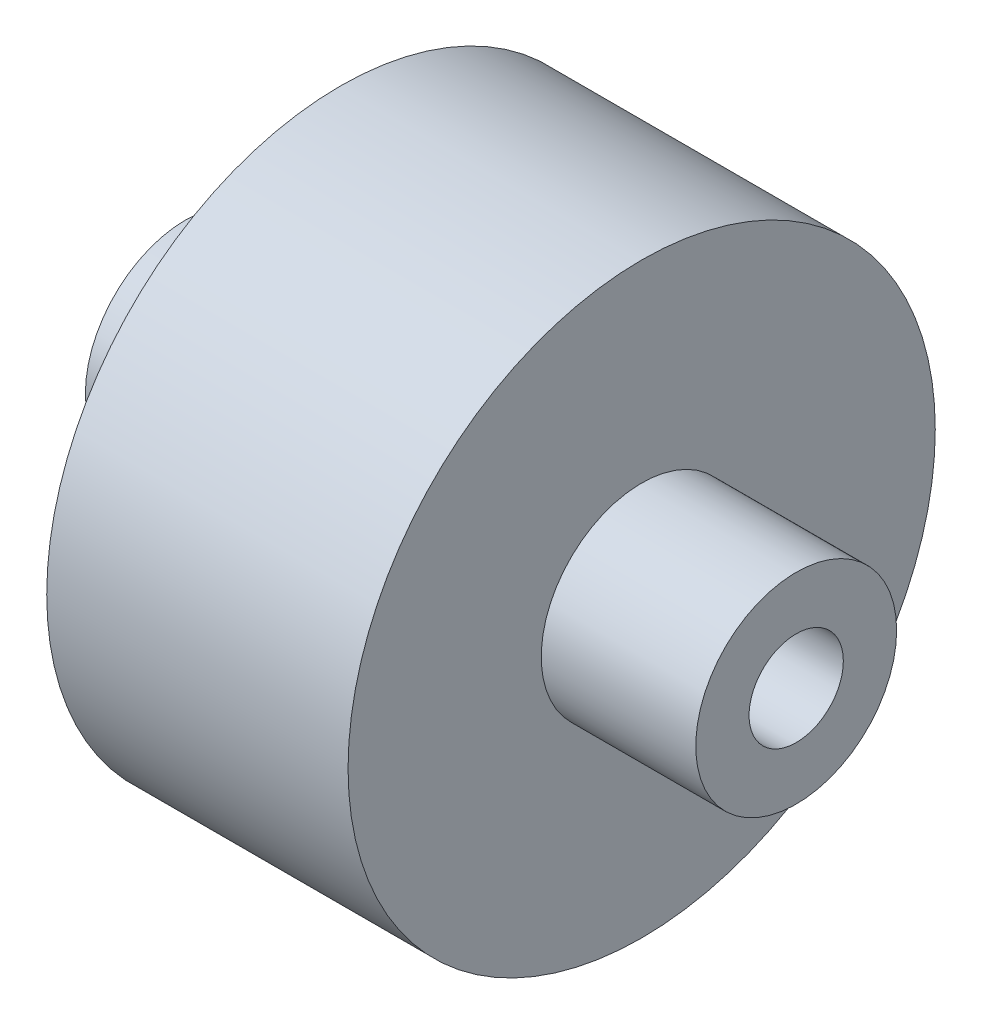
SolidWorks part; units mm, degrees
ref_plane "Front Plane" through (0, 0, 0) normal (0, 0, 1) x (1, 0, 0)
ref_plane "Top Plane" through (0, 0, 0) normal (0, 1, 0) x (1, 0, 0)
ref_plane "Right Plane" through (0, 0, 0) normal (1, 0, 0) x (0, 0, -1)
sketch "Sketch1" plane through (0, 0, 0) normal (1, 0, 0) x (0, 0, -1)
  circle A0 centre (0, 0) radius 19
  dimension "D1" = 38
extrude "Boss-Extrude1" add sketch "Sketch1" along normal blind 19.5
sketch "Sketch2" plane through (19.5, 0, 0) normal (1, 0, 0) x (0, 0, -1)
  circle A0 centre (0, 0) radius 6.5
  dimension "D1" = 13
extrude "Boss-Extrude2" add sketch "Sketch2" along normal blind 10
sketch "Sketch3" plane through (0, 0, 0) normal (-1, 0, 0) x (0, 0, 1)
  circle A0 centre (0, 0) radius 6.5
  dimension "D1" = 13
extrude "Boss-Extrude3" add sketch "Sketch3" along normal blind 10
sketch "Sketch4" plane through (29.5, 0, 0) normal (1, 0, 0) x (0, 0, -1)
  circle A0 centre (0, 0) radius 3.05
  dimension "D1" = 6.1
extrude "Cut-Extrude1" cut sketch "Sketch4" against normal through all both and the other way through all
